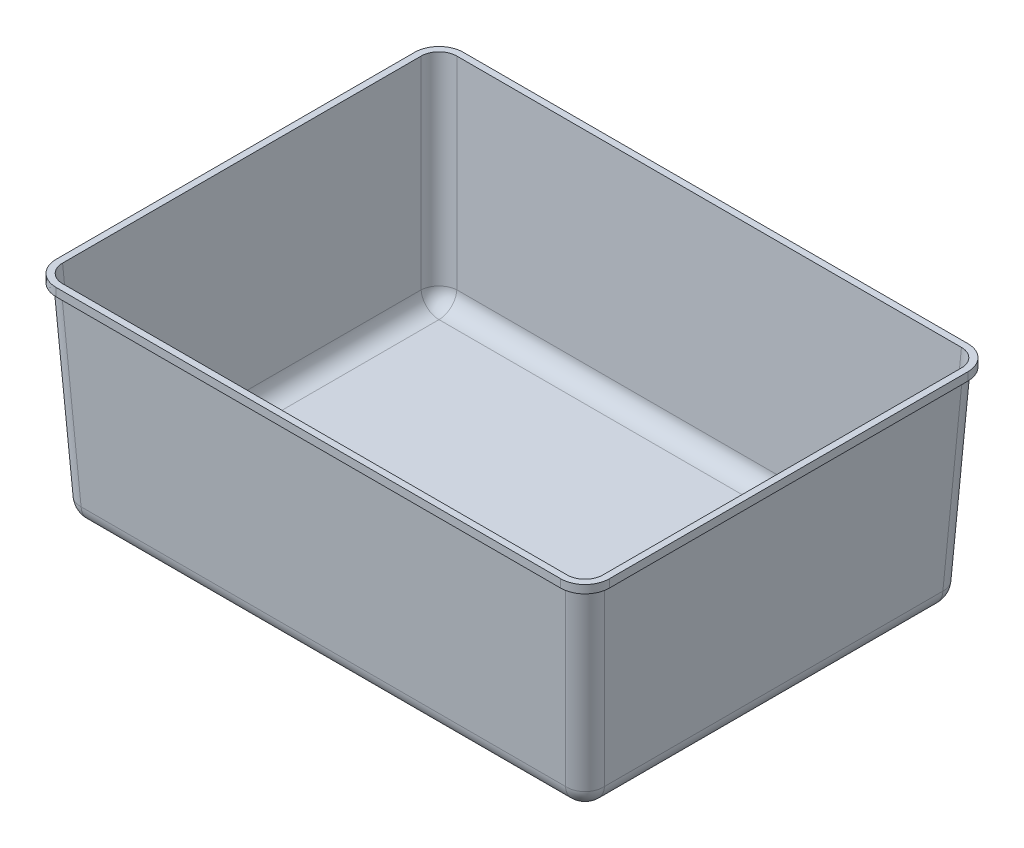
SolidWorks part; units mm, degrees
ref_plane "Plan de face" through (0, 0, 0) normal (0, 0, 1) x (1, 0, 0)
ref_plane "Plan de dessus" through (0, 0, 0) normal (0, 1, 0) x (1, 0, 0)
ref_plane "Plan de droite" through (0, 0, 0) normal (1, 0, 0) x (0, 0, -1)
sketch "Esquisse1" plane through (0, 0, 0) normal (0, 1, 0) x (1, 0, 0)
  line L1 (0, 0) -> (335, 0)
  line L2 (0, 0) -> (0, 245)
  line L3 (0, 245) -> (335, 245)
  line L4 (335, 0) -> (335, 245)
  dimension "D1" = 335
  dimension "D2" = 245
extrude "Extrusion1" add sketch "Esquisse1" against normal blind 130 draft 3
ref_plane "Plan1" through (0, 0, -122.5) normal (0, 0, 1) x (1, 0, 0)
ref_plane "Plan2" through (167.5, 0, 0) normal (1, 0, 0) x (0, 0, -1)
fillet "Congé1" radius 12 8 edges at (328.187, -130, -122.5) (167.5, -130, -238.187) (6.813, -130, -122.5) (167.5, -130, -6.813) (3.4065, -65, -241.5935) (331.5935, -65, -241.5935) (331.5935, -65, -3.4065) (3.4065, -65, -3.4065)
shell "Coque1" thickness 1
sketch "Esquisse3" plane through (0, 0, 0) normal (0, 1, 0) x (-1, 0, 0)
  line L8 (-338, -11.9836) -> (-338, -233.0164)
  line L9 (-323.0164, -248) -> (-11.9836, -248)
  line L10 (3, -233.0164) -> (3, -11.9836)
  line L11 (-11.9836, 3) -> (-323.0164, 3)
  line L12 (-338, -11.9836) -> (-338, -233.0164)
  line L13 (-323.0164, -248) -> (-11.9836, -248)
  line L14 (3, -233.0164) -> (3, -11.9836)
  line L15 (-11.9836, 3) -> (-323.0164, 3)
  line L21 (-333.9986, -11.9863) -> (-333.9986, -233.0137)
  line L22 (-11.9863, -1.0014) -> (-323.0137, -1.0014)
  line L23 (-1.0014, -233.0137) -> (-1.0014, -11.9863)
  line L24 (-323.0137, -243.9986) -> (-11.9863, -243.9986)
  line L25 (-333.9986, -11.9863) -> (-333.9986, -233.0137)
  line L26 (-11.9863, -1.0014) -> (-323.0137, -1.0014)
  line L27 (-1.0014, -233.0137) -> (-1.0014, -11.9863)
  line L28 (-323.0137, -243.9986) -> (-11.9863, -243.9986)
  ellipse E12 centre (-322.9835, -232.9835) end of major axis (-330.783, -240.783) minor radius 11 (-333.9986, -233.0137) -> (-323.0137, -243.9986) ccw
  ellipse E13 centre (-322.9835, -12.0165) end of major axis (-315.184, -19.816) minor radius 11 (-323.0137, -1.0014) -> (-333.9986, -11.9863) ccw
  ellipse E14 centre (-12.0165, -12.0165) end of major axis (-4.217, -4.217) minor radius 11 (-1.0014, -11.9863) -> (-11.9863, -1.0014) ccw
  ellipse E15 centre (-12.0165, -232.9835) end of major axis (-19.816, -225.184) minor radius 11 (-11.9863, -243.9986) -> (-1.0014, -233.0137) ccw
  ellipse E16 centre (-322.9835, -232.9835) end of major axis (-330.783, -240.783) minor radius 11 (-333.9986, -233.0137) -> (-323.0137, -243.9986) ccw
  ellipse E17 centre (-322.9835, -12.0165) end of major axis (-330.783, -4.217) minor radius 11 (-323.0137, -1.0014) -> (-333.9986, -11.9863) ccw
  ellipse E18 centre (-12.0165, -12.0165) end of major axis (-4.217, -4.217) minor radius 11 (-1.0014, -11.9863) -> (-11.9863, -1.0014) ccw
  ellipse E19 centre (-12.0165, -232.9835) end of major axis (-4.217, -240.783) minor radius 11 (-11.9863, -243.9986) -> (-1.0014, -233.0137) ccw
  spline S0 degree 3 poles (-338, -233.0164) (-338, -234.0056) (-337.9032, -234.98) (-337.6172, -236.42) (-337.4982, -236.8964) (-337.2116, -237.8417) (-337.0454, -238.3057) (-336.4837, -239.6612) (-336.0245, -240.5216) (-335.2071, -241.7464) (-334.9114, -242.1454) (-334.2881, -242.9049) (-333.9597, -243.267) (-332.9252, -244.3018) (-332.1698, -244.9236) (-330.5258, -246.0226) (-329.6634, -246.4825) (-328.3116, -247.0431) (-327.8513, -247.2083) (-326.9106, -247.4943) (-326.4292, -247.6151) (-324.9824, -247.9032) (-324.0056, -248) (-323.0164, -248) knots 0 0 0 0 0.125 0.125 0.1875 0.1875 0.25 0.25 0.375 0.375 0.4375 0.4375 0.5 0.5 0.625 0.625 0.75 0.75 0.8125 0.8125 0.875 0.875 1 1 1 1
  spline S1 degree 3 poles (-11.9836, -248) (-10.9944, -248) (-10.02, -247.9032) (-8.58, -247.6172) (-8.1036, -247.4982) (-7.1583, -247.2116) (-6.6943, -247.0454) (-5.3388, -246.4837) (-4.4784, -246.0245) (-3.2536, -245.2071) (-2.8546, -244.9114) (-2.0951, -244.2881) (-1.733, -243.9597) (-0.6982, -242.9252) (-0.0764, -242.1698) (1.0226, -240.5258) (1.4825, -239.6634) (2.0431, -238.3116) (2.2083, -237.8513) (2.4943, -236.9106) (2.6151, -236.4292) (2.9032, -234.9824) (3, -234.0056) (3, -233.0164) knots 0 0 0 0 0.125 0.125 0.1875 0.1875 0.25 0.25 0.375 0.375 0.4375 0.4375 0.5 0.5 0.625 0.625 0.75 0.75 0.8125 0.8125 0.875 0.875 1 1 1 1
  spline S2 degree 3 poles (3, -11.9836) (3, -10.9944) (2.9032, -10.02) (2.6172, -8.58) (2.4982, -8.1036) (2.2116, -7.1583) (2.0454, -6.6943) (1.4837, -5.3388) (1.0245, -4.4784) (0.2071, -3.2536) (-0.0886, -2.8546) (-0.7119, -2.0951) (-1.0403, -1.733) (-2.0748, -0.6982) (-2.8302, -0.0764) (-4.4742, 1.0226) (-5.3366, 1.4825) (-6.6884, 2.0431) (-7.1487, 2.2083) (-8.0894, 2.4943) (-8.5708, 2.6151) (-10.0176, 2.9032) (-10.9944, 3) (-11.9836, 3) knots 0 0 0 0 0.125 0.125 0.1875 0.1875 0.25 0.25 0.375 0.375 0.4375 0.4375 0.5 0.5 0.625 0.625 0.75 0.75 0.8125 0.8125 0.875 0.875 1 1 1 1
  spline S3 degree 3 poles (-323.0164, 3) (-324.0056, 3) (-324.98, 2.9032) (-326.42, 2.6172) (-326.8964, 2.4982) (-327.8417, 2.2116) (-328.3057, 2.0454) (-329.6612, 1.4837) (-330.5216, 1.0245) (-331.7464, 0.2071) (-332.1454, -0.0886) (-332.9049, -0.7119) (-333.267, -1.0403) (-334.3018, -2.0748) (-334.9236, -2.8302) (-336.0226, -4.4742) (-336.4825, -5.3366) (-337.0431, -6.6884) (-337.2083, -7.1487) (-337.4943, -8.0894) (-337.6151, -8.5708) (-337.9032, -10.0176) (-338, -10.9944) (-338, -11.9836) knots 0 0 0 0 0.125 0.125 0.1875 0.1875 0.25 0.25 0.375 0.375 0.4375 0.4375 0.5 0.5 0.625 0.625 0.75 0.75 0.8125 0.8125 0.875 0.875 1 1 1 1
  spline S4 degree 3 poles (-338, -233.0164) (-338, -234.0056) (-337.9032, -234.98) (-337.6172, -236.42) (-337.4982, -236.8964) (-337.2116, -237.8417) (-337.0454, -238.3057) (-336.4837, -239.6612) (-336.0245, -240.5216) (-335.2071, -241.7464) (-334.9114, -242.1454) (-334.2881, -242.9049) (-333.9597, -243.267) (-332.9252, -244.3018) (-332.1698, -244.9236) (-330.5258, -246.0226) (-329.6634, -246.4825) (-328.3116, -247.0431) (-327.8513, -247.2083) (-326.9106, -247.4943) (-326.4292, -247.6151) (-324.9824, -247.9032) (-324.0056, -248) (-323.0164, -248) knots 0 0 0 0 0.125 0.125 0.1875 0.1875 0.25 0.25 0.375 0.375 0.4375 0.4375 0.5 0.5 0.625 0.625 0.75 0.75 0.8125 0.8125 0.875 0.875 1 1 1 1
  spline S5 degree 3 poles (-11.9836, -248) (-10.9944, -248) (-10.02, -247.9032) (-8.58, -247.6172) (-8.1036, -247.4982) (-7.1583, -247.2116) (-6.6943, -247.0454) (-5.3388, -246.4837) (-4.4784, -246.0245) (-3.2536, -245.2071) (-2.8546, -244.9114) (-2.0951, -244.2881) (-1.733, -243.9597) (-0.6982, -242.9252) (-0.0764, -242.1698) (1.0226, -240.5258) (1.4825, -239.6634) (2.0431, -238.3116) (2.2083, -237.8513) (2.4943, -236.9106) (2.6151, -236.4292) (2.9032, -234.9824) (3, -234.0056) (3, -233.0164) knots 0 0 0 0 0.125 0.125 0.1875 0.1875 0.25 0.25 0.375 0.375 0.4375 0.4375 0.5 0.5 0.625 0.625 0.75 0.75 0.8125 0.8125 0.875 0.875 1 1 1 1
  spline S6 degree 3 poles (3, -11.9836) (3, -10.9944) (2.9032, -10.02) (2.6172, -8.58) (2.4982, -8.1036) (2.2116, -7.1583) (2.0454, -6.6943) (1.4837, -5.3388) (1.0245, -4.4784) (0.2071, -3.2536) (-0.0886, -2.8546) (-0.7119, -2.0951) (-1.0403, -1.733) (-2.0748, -0.6982) (-2.8302, -0.0764) (-4.4742, 1.0226) (-5.3366, 1.4825) (-6.6884, 2.0431) (-7.1487, 2.2083) (-8.0894, 2.4943) (-8.5708, 2.6151) (-10.0176, 2.9032) (-10.9944, 3) (-11.9836, 3) knots 0 0 0 0 0.125 0.125 0.1875 0.1875 0.25 0.25 0.375 0.375 0.4375 0.4375 0.5 0.5 0.625 0.625 0.75 0.75 0.8125 0.8125 0.875 0.875 1 1 1 1
  spline S7 degree 3 poles (-323.0164, 3) (-324.0056, 3) (-324.98, 2.9032) (-326.42, 2.6172) (-326.8964, 2.4982) (-327.8417, 2.2116) (-328.3057, 2.0454) (-329.6612, 1.4837) (-330.5216, 1.0245) (-331.7464, 0.2071) (-332.1454, -0.0886) (-332.9049, -0.7119) (-333.267, -1.0403) (-334.3018, -2.0748) (-334.9236, -2.8302) (-336.0226, -4.4742) (-336.4825, -5.3366) (-337.0431, -6.6884) (-337.2083, -7.1487) (-337.4943, -8.0894) (-337.6151, -8.5708) (-337.9032, -10.0176) (-338, -10.9944) (-338, -11.9836) knots 0 0 0 0 0.125 0.125 0.1875 0.1875 0.25 0.25 0.375 0.375 0.4375 0.4375 0.5 0.5 0.625 0.625 0.75 0.75 0.8125 0.8125 0.875 0.875 1 1 1 1
  dimension "D2" = 0
  dimension "D1" = 3
extrude "Extrusion5" add sketch "Esquisse3" against normal blind 5
sketch "Esquisse4" plane through (0, -130, 0) normal (0, -1, 0) x (1, 0, 0)
  line L1 (316.7994, -226.7994) -> (316.7994, -18.2006) construction
  line L3 (316.7994, -176.7994) -> (164.4543, -176.7994) construction
  line L4 (18.2006, -226.7994) -> (316.7994, -226.7994) construction
  circle A0 centre (266.7994, -176.7994) radius 13.5
  dimension "D1" = 27
  dimension "D2" = 50
  dimension "D3" = 50
extrude "Enlèv. mat.-Extru.1" cut sketch "Esquisse4" against normal blind 10
